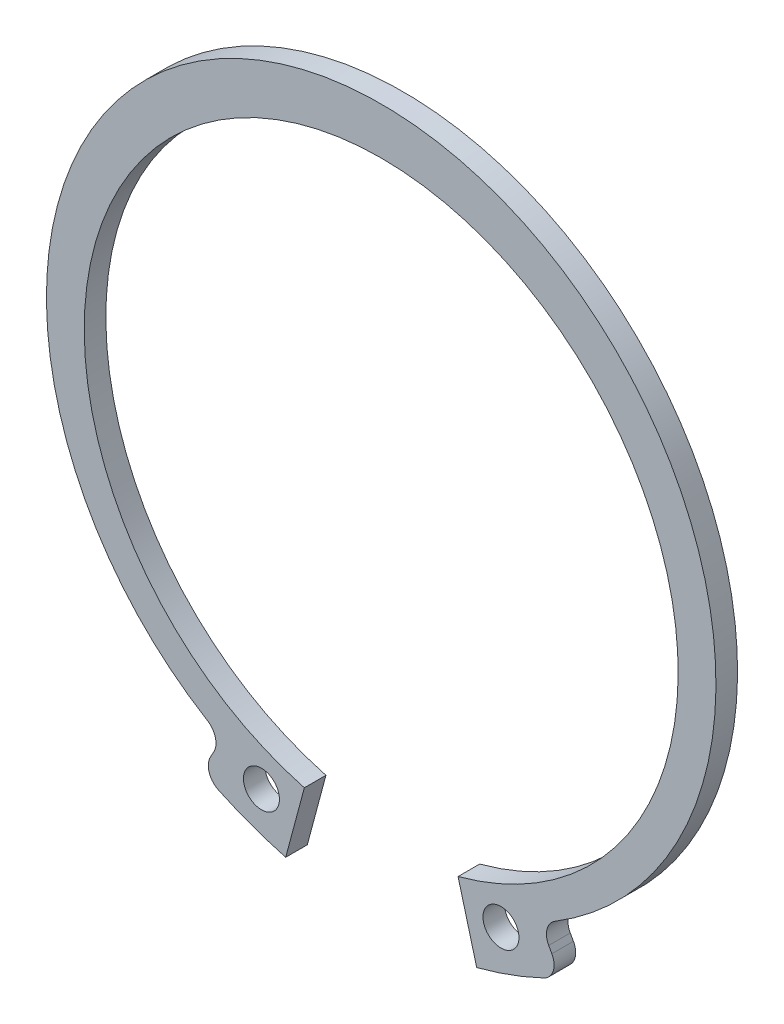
SolidWorks part; units mm, degrees
ref_plane "Plan1" through (0, 0, 0) normal (0, 0, 1) x (1, 0, 0)
ref_plane "Plan2" through (0, 0, 0) normal (0, 1, 0) x (1, 0, 0)
ref_plane "Plan3" through (0, 0, 0) normal (1, 0, 0) x (0, 0, -1)
sketch "Esquisse1" plane through (0, 0, 0) normal (0, 0, 1) x (1, 0, 0)
  line L0 (0, 0) -> (5.3058, -19.8015) construction
  line L1 (0, 0) -> (0, -67.082) construction
  line L2 (9.3055, -16.7352) -> (9.4801, -17.0492)
  line L3 (4.2705, -15.9378) -> (5.3058, -19.8015)
  line L4 (-4.2705, -15.9378) -> (-5.3058, -19.8015)
  line L5 (-9.3055, -16.7352) -> (-9.4801, -17.0492)
  line L6 (4.2705, -15.9378) -> (9.0368, -18.4377) construction
  line L7 (0, 0) -> (0, 16.5) construction
  line L8 (0, 16.5) -> (0, 19.1) construction
  arc A0 (4.2705, -15.9378) -> (-4.2705, -15.9378) centre (0, 0) ccw
  arc A1 (5.3058, -19.8015) -> (9.0368, -18.4377) centre (0, 0.5) ccw
  arc A2 (9.6601, -15.3947) -> (-9.6601, -15.3947) centre (0, 0.5) ccw
  arc A3 (-9.0368, -18.4377) -> (-5.3058, -19.8015) centre (0, 0.5) ccw
  arc A4 (-9.6601, -15.3947) -> (-9.3055, -16.7352) centre (-10.1795, -16.2493) cw
  arc A5 (9.6601, -15.3947) -> (9.3055, -16.7352) centre (10.1795, -16.2493) ccw
  circle A6 centre (6.6537, -17.1877) radius 1
  circle A7 centre (-6.6537, -17.1877) radius 1
  arc A8 (-9.0368, -18.4377) -> (-9.4801, -17.0492) centre (-8.6062, -17.5352) cw
  arc A9 (9.0368, -18.4377) -> (9.4801, -17.0492) centre (8.6062, -17.5352) ccw
  point P8 (0, 0)
  point P22 (-9.9842, -17.9558)
  dimension "D1" = 33
  dimension "D2" = 4
  dimension "D3" = 2.6
  dimension "R" = 1
  dimension "D8" = 2
  dimension "D4" = 0.5
  dimension "D5" = 5
  dimension "a" = 15
extrude "Base-Extrusion" add sketch "Esquisse1" along normal blind 1.2
equation "\"R@Esquisse1\" = \"D8@Esquisse1\"/2"
equation "\"D4@Esquisse1\"=\"R@Esquisse1\"/2"
equation "\"D5@Esquisse1\"=\"D8@Esquisse1\"*2.5"
